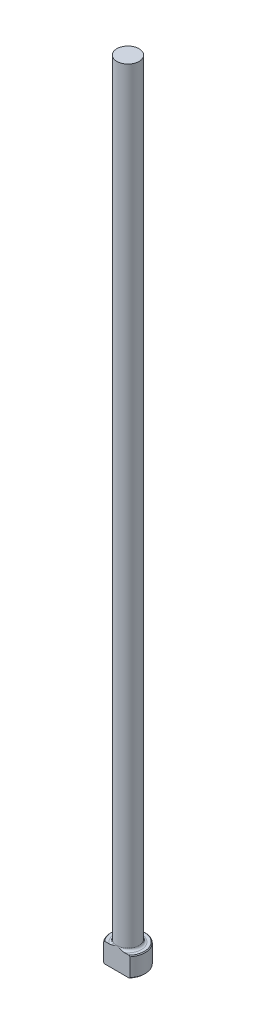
SolidWorks part; units mm, degrees
ref_plane "Front Plane" through (0, 0, 0) normal (0, 0, 1) x (1, 0, 0)
ref_plane "Top Plane" through (0, 0, 0) normal (0, 1, 0) x (1, 0, 0)
ref_plane "Right Plane" through (0, 0, 0) normal (1, 0, 0) x (0, 0, -1)
sketch "Sketch1" plane through (0, 0, 0) normal (0, 0, 1) x (1, 0, 0)
  line L0 (0, 259.9588) -> (0, -15.1925) construction
  line L1 (0, 0) -> (-5.5499, 0)
  line L2 (-5.5499, 0) -> (-5.5499, 6.35)
  line L3 (-5.5499, 6.35) -> (-3.5712, 6.35)
  line L4 (-3.5712, 6.35) -> (-3.5712, 254)
  line L5 (-3.5712, 254) -> (0, 254)
  line L6 (0, 254) -> (0, 0)
  dimension "L" = 254
  dimension "H" = 11.0998
  dimension "T" = 6.35
  dimension "D" = 7.1425
revolve "Revolve1" add sketch "Sketch1" angle 360 about L0
chamfer "Chamfer1" distance 0.254 angle 45 2 edges at (0, 6.35, 5.5499) (0, 0, 5.5499)
fillet "Fillet1" radius 0.762 1 edges at (0, 6.35, 3.5712)
sketch "Sketch2" plane through (0, 0, 0) normal (0, -1, 0) x (1, 0, 0)
  line L0 (-4.2483, 3.5712) -> (4.2483, 3.5712)
  arc A0 (4.2483, 3.5712) -> (-4.2483, 3.5712) centre (0, 0) ccw
  circle A1 centre (0, 0) radius 5.5499 construction
  circle A3 centre (0, 0) radius 3.5712 construction
extrude "KEY" cut sketch "Sketch2" against normal through all
sketch "Pocket Sketch" plane through (0, 0, 0) normal (0, 0, 1) x (1, 0, 0)
  line L0 (-5.9468, 0) -> (-5.9468, 6.3754)
  line L1 (-5.9468, 6.3754) -> (-4.7301, 6.3754)
  line L2 (-3.9681, 7.1374) -> (-3.9681, 22.225)
  line L3 (-3.9681, 22.225) -> (0, 22.225)
  line L4 (0, 22.225) -> (0, 0)
  line L5 (0, 0) -> (-5.9468, 0)
  line L6 (0, 12.6104) -> (0, -2.4989) construction
  line L7 (-5.5499, 6.096) -> (-5.5499, 0.254) construction
  line L8 (5.2959, 6.35) -> (-5.2959, 6.35) construction
  line L9 (-3.5712, 254) -> (-3.5712, 7.112) construction
  line L10 (-4.7301, 6.3754) -> (-3.9681, 7.1374)
  point P3 (-3.9681, 6.3754)
  dimension "D1" = 11.8935
  dimension "D2" = 0.3969
  dimension "D3" = 0.0254
  dimension "D4" = 0.3969
  dimension "D5" = 7.9362
  dimension "D6" = 22.225
